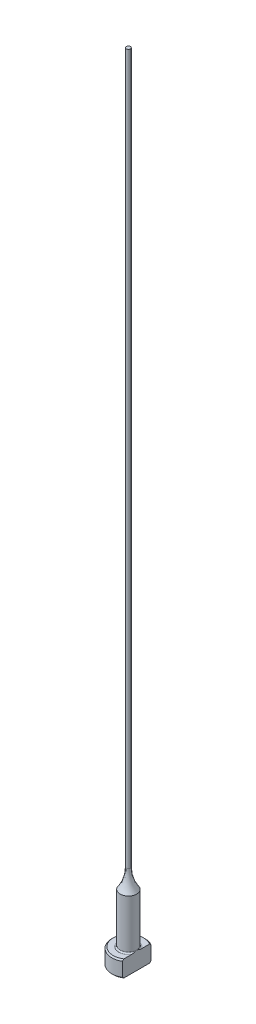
SolidWorks part; units mm, degrees
ref_plane "Front Plane" through (0, 0, 0) normal (0, 0, 1) x (1, 0, 0)
ref_plane "Top Plane" through (0, 0, 0) normal (0, 1, 0) x (1, 0, 0)
ref_plane "Right Plane" through (0, 0, 0) normal (1, 0, 0) x (0, 0, -1)
sketch "Sketch1" plane through (0, 0, 0) normal (0, 0, 1) x (1, 0, 0)
  line L0 (0, 259.9588) -> (0, -15.1925) construction
  line L1 (0, 0) -> (-3.175, 0)
  line L2 (-3.175, 0) -> (-3.175, 3.175)
  line L3 (-3.175, 3.175) -> (-1.5875, 3.175)
  line L4 (-0.3962, 16.4027) -> (-0.3962, 152.4)
  line L5 (-0.3962, 152.4) -> (0, 152.4)
  line L6 (0, 152.4) -> (0, 0)
  line L7 (-1.5875, 3.175) -> (-1.5875, 12.7)
  arc A0 (-1.5875, 12.7) -> (-0.3962, 16.4027) centre (-6.7462, 16.4027) ccw
  point P13 (-1.5875, 0)
  dimension "D1" = 6.35
  dimension "L" = 152.4
  dimension "D2" = 3.175
  dimension "H" = 6.35
  dimension "T" = 3.175
  dimension "D" = 0.7925
  dimension "S" = 12.7
revolve "Revolve1" add sketch "Sketch1" angle 360 about L0
chamfer "Chamfer1" distance 0.254 angle 45 2 edges at (0, 3.175, 3.175) (0, 0, 3.175)
fillet "Fillet1" radius 0.254 1 edges at (0, 3.175, 1.5875)
sketch "Sketch2" plane through (0, 0, 0) normal (0, 1, 0) x (1, 0, 0)
  line L0 (1.5875, -2.7496) -> (1.5875, 2.7496)
  circle A0 centre (0, 0) radius 3.175 construction
  arc A2 (1.5875, -2.7496) -> (1.5875, 2.7496) centre (0, 0) ccw
  circle A3 centre (0, 0) radius 3.175 construction
  circle A4 centre (0, 0) radius 1.5875 construction
extrude "Key Head" cut sketch "Sketch2" along normal up to next
